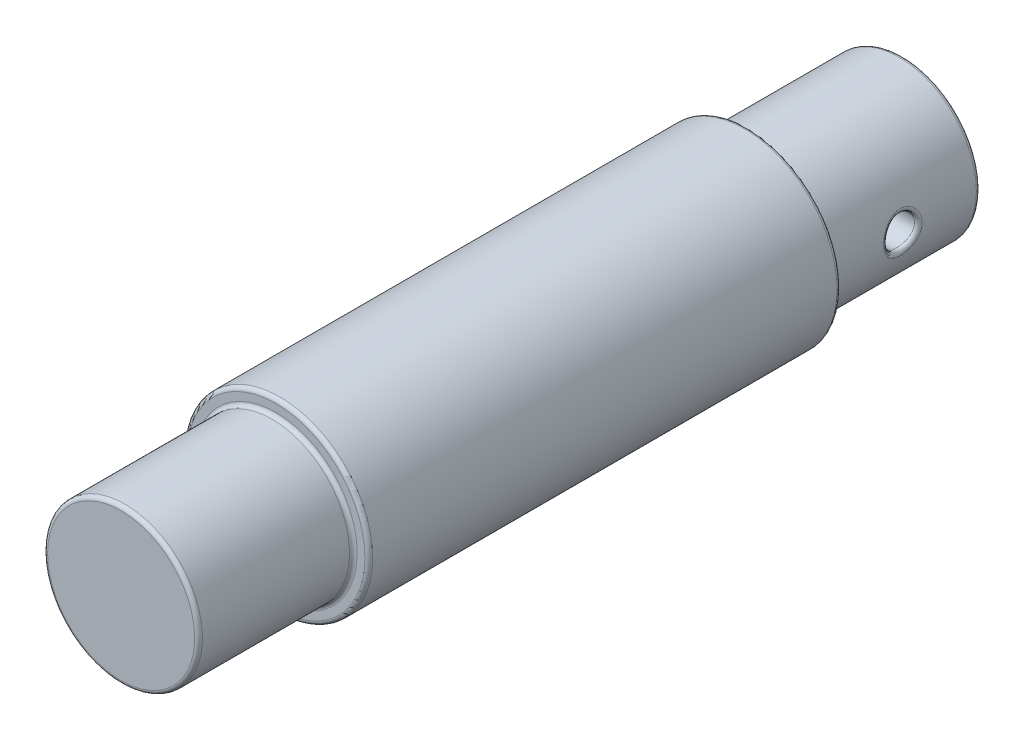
SolidWorks part; units mm, degrees
ref_plane "Спереди" through (0, 0, 0) normal (0, 0, 1) x (1, 0, 0)
ref_plane "Сверху" through (0, 0, 0) normal (0, 1, 0) x (1, 0, 0)
ref_plane "Справа" through (0, 0, 0) normal (1, 0, 0) x (0, 0, -1)
sketch "Эскиз1" plane through (0, 0, 0) normal (1, 0, 0) x (0, 0, -1)
  line L0 (-50.5, 0) -> (50.5, 0)
  line L1 (-50.5, 0) -> (-50.5, 10)
  line L2 (-50.5, 10) -> (-30.5, 10)
  line L3 (-30.5, 10) -> (-30.5, 12)
  line L4 (-30.5, 12) -> (30.5, 12)
  line L5 (30.5, 12) -> (30.5, 10)
  line L6 (30.5, 10) -> (50.5, 10)
  line L7 (50.5, 10) -> (50.5, 0)
  dimension "D1" = 101
  dimension "D2" = 10
  dimension "D3" = 12
  dimension "D4" = 61
revolve "Повернуть1" add sketch "Эскиз1" angle 360 about L0
sketch "Эскиз2" plane through (0, 0, 0) normal (1, 0, 0) x (0, 0, -1)
  line L0 (50.5, -10) -> (50.5, 10) construction
  circle A0 centre (40.5, 0) radius 2
  dimension "D1" = 4
  dimension "D2" = 10
extrude "Вырез-Вытянуть1" cut sketch "Эскиз2" against normal mid plane 20
fillet "Скругление1" radius 0.5 8 edges at (12, 0, -30.5) (12, 0, 30.5) (10, 0, -50.5) (10, 0, -30.5) (-9.9914, -0.4155, -38.5436) (9.9914, 0.4155, -38.5436) (10, 0, 30.5) (10, 0, 50.5)
